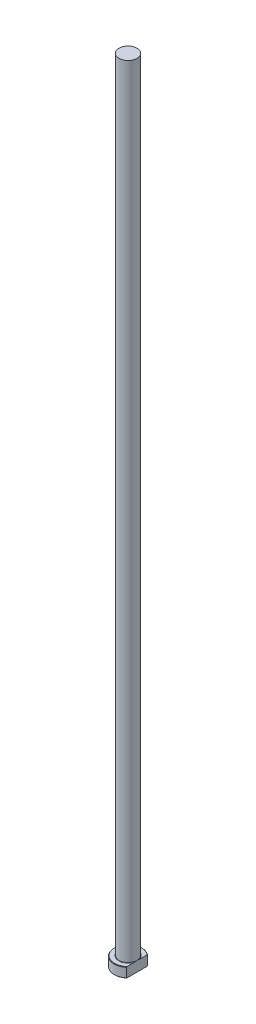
SolidWorks part; units mm, degrees
ref_plane "Front Plane" through (0, 0, 0) normal (0, 0, 1) x (1, 0, 0)
ref_plane "Top Plane" through (0, 0, 0) normal (0, 1, 0) x (1, 0, 0)
ref_plane "Right Plane" through (0, 0, 0) normal (1, 0, 0) x (0, 0, -1)
sketch "Sketch1" plane through (0, 0, 0) normal (0, 0, 1) x (1, 0, 0)
  line L0 (0, 259.9588) -> (0, -15.1925) construction
  line L1 (0, 0) -> (-7, 0)
  line L2 (-7, 0) -> (-7, 5)
  line L3 (-7, 5) -> (-4.5, 5)
  line L4 (-4.5, 5) -> (-4.5, 400)
  line L5 (-4.5, 400) -> (0, 400)
  line L6 (0, 400) -> (0, 0)
  dimension "L" = 400
  dimension "H" = 14
  dimension "T" = 5
  dimension "D" = 9
revolve "Revolve1" add sketch "Sketch1" angle 360 about L0
chamfer "Chamfer1" distance 0.2 angle 45 2 edges at (0, 5, 7) (0, 0, 7)
fillet "Fillet1" radius 0.2 1 edges at (0, 5, 4.5)
sketch "Sketch2" plane through (0, 0, 0) normal (0, 1, 0) x (1, 0, 0)
  line L0 (4.5, 5.3619) -> (4.5, -5.3619)
  circle A0 centre (0, 0) radius 7 construction
  arc A1 (4.5, -5.3619) -> (4.5, 5.3619) centre (0, 0) ccw
  circle A2 centre (0, 0) radius 4.5 construction
extrude "KEY" cut sketch "Sketch2" along normal through all
